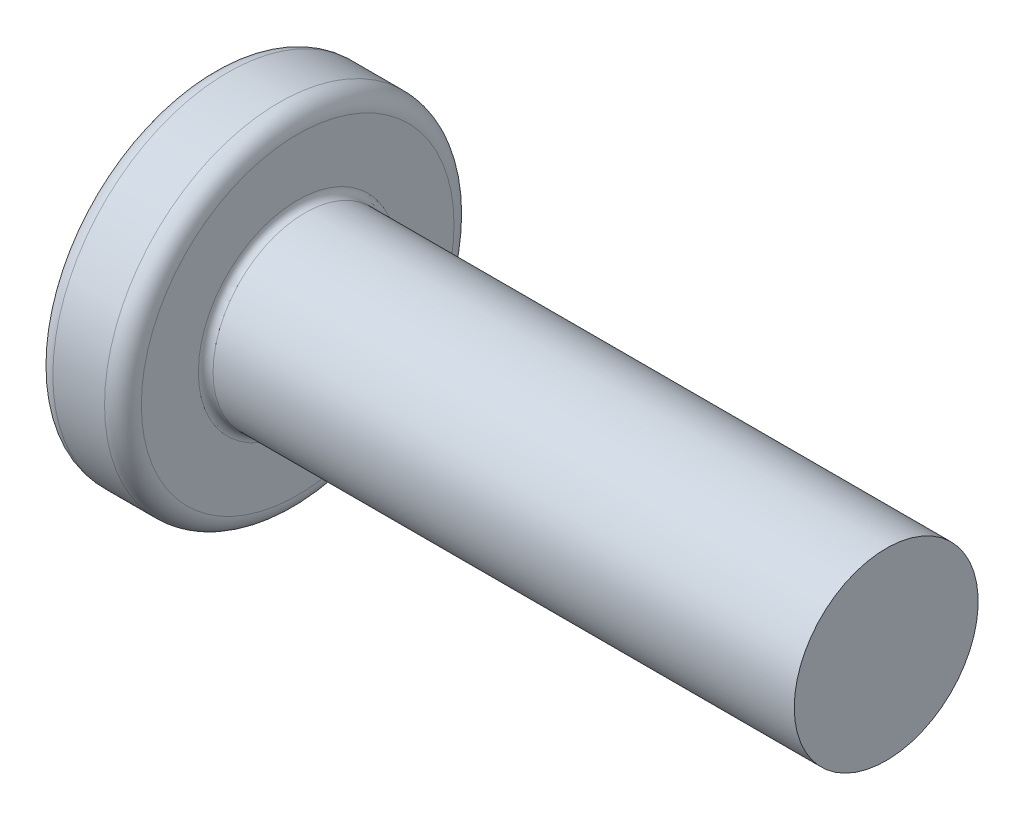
SolidWorks part; units mm, degrees
ref_plane "Plane1" through (0, 0, 0) normal (0, 0, 1) x (1, 0, 0)
ref_plane "Plane2" through (0, 0, 0) normal (0, 1, 0) x (1, 0, 0)
ref_plane "Plane3" through (0, 0, 0) normal (1, 0, 0) x (0, 0, -1)
sketch "BodySke" plane through (0, 0, 0) normal (0, 0, 1) x (1, 0, 0)
  line L0 (3.7, 2.5) -> (3.7, 4.75)
  line L1 (4.1, 6.35) -> (4.1, -3.175) construction
  line L2 (-25.4, 0) -> (127, 0) construction
  line L3 (19.7, 0) -> (0, 0)
  line L4 (3.7, 2.5) -> (19.7, 2.5)
  line L5 (19.7, 2.5) -> (19.7, 0)
  line L6 (1.7942, 4.75) -> (3.7, 4.75)
  line L8 (3.7, 6.35) -> (3.7, -3.175) construction
  arc A0 (1.4243, 4.5563) -> (0, 0) centre (8, 0) ccw
  arc A2 (1.4243, 4.5563) -> (1.7942, 4.75) centre (1.7942, 4.3) cw
  dimension "Head_fillet_rad" = 0.45
  dimension "Head_crown_rad" = 8
  dimension "Head_ht" = 3.7
  dimension "Diameter" = 5
  dimension "Length" = 16
  dimension "Head_dia" = 9.5
  dimension "Advance" = 0.8
  dimension "Thread_nom" = 16
revolve "Base-Revolve" add sketch "BodySke"
fillet "Fillet1" radius 0.2 1 edges at (3.7, 0, 2.5)
sketch "Sketch3" plane through (0, 0, 0) normal (1, 0, 0) x (0, 0, -1)
  line L0 (0.515, -2.35) -> (-0.515, -2.35)
  line L1 (0.515, -2.35) -> (0.515, 2.35)
  line L2 (-0.515, 2.35) -> (0.515, 2.35)
  line L3 (-0.515, 2.35) -> (-0.515, -2.35)
  dimension "D1" = 2.35
  dimension "Cross_dia" = 4.7
  dimension "D2" = 0.515
  dimension "Cross_width" = 1.03
ref_plane "Plane4" through (2.74, 0, 0) normal (1, 0, 0) x (0, 0, -1)
sketch "Sketch4" plane through (2.74, 0, 0) normal (1, 0, 0) x (0, 0, -1)
  line L0 (0.515, -0.9839) -> (-0.515, -0.9839)
  line L1 (0.515, -0.9839) -> (0.515, 0.9839)
  line L2 (-0.515, 0.9839) -> (0.515, 0.9839)
  line L3 (-0.515, 0.9839) -> (-0.515, -0.9839)
  dimension "D1" = 1.03
  dimension "D2" = 1.9678
  dimension "D3" = 0.515
  dimension "D4" = 0.9839
loft "Recess" cut profiles "Sketch3", "Sketch4"
pattern_circular "RecPat" count 2 every 90 about axis through (0, 0, 0) along (1, 0, 0) of "Recess"
sketch "RecCorSke" plane through (0, 0, 0) normal (0, 0, 1) x (1, 0, 0)
  line L0 (-3.175, 0) -> (15.875, 0) construction
  line L1 (-25.4, 0) -> (127, 0) construction
  line L2 (0, 0) -> (0, 1.0426)
  line L3 (0, 1.0426) -> (2.74, 0.851)
  line L4 (2.74, 0.851) -> (3.0165, 0)
  line L5 (3.0165, 0) -> (0, 0)
  dimension "Diameter" = 1.702
  dimension "Depth" = 2.74
  dimension "Draft_angle" = 4
  dimension "Bottom_angle" = 18
revolve "RecessCore" cut sketch "RecCorSke" angle 360 about L0
sketch "ThdSchSke" plane through (0, 0, 0) normal (0, 0, 1) x (1, 0, 0)
  line L0 (5.3, -2.055) -> (4.9884, -2.5)
  line L1 (5.3, -2.055) -> (5.6116, -2.5)
  line L2 (5.6116, -2.5) -> (5.6116, -3.125)
  line L3 (-3.175, 0) -> (5.1513, 0) construction
  line L5 (5.6116, -3.125) -> (4.9884, -3.125)
  line L6 (4.9884, -3.125) -> (4.9884, -2.5)
  dimension "Thread_minor" = 4.11
  dimension "Diameter" = 5
  dimension "Start" = 5.3
  dimension "SideAngle" = 55
  dimension "VeeAngle" = 70
  dimension "Overcut" = 6.25
revolve "ThreadSchematic" [suppressed] cut sketch "ThdSchSke" angle 360 about L3
pattern_linear "ThdSchPat" [suppressed]
fillet "Congé1" radius 0.5 1 edges at (3.7, 0, 4.75)
equation "\"D1@Sketch3\" = \"Cross_dia@Sketch3\" / 2"
equation "\"D2@Sketch3\" = \"Cross_width@Sketch3\" / 2"
equation "\"Depth@RecCorSke\" = \"Cross_depth@Plane4\""
equation "\"D1@Sketch4\" = \"Cross_width@Sketch3\""
equation "\"D2@Sketch4\" = \"Cross_dia@Sketch3\" - 2.0 * \"Cross_depth@Plane4\" * tan(26.5  * 0.017453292)"
equation "\"D3@Sketch4\" = \"D1@Sketch4\" / 2"
equation "\"D4@Sketch4\" = \"D2@Sketch4\" / 2"
equation "\"Thread_length@ThreadCosmetic\" = ((sgn( (\"Length@BodySke\" - \"Advance@BodySke\" * 2.0 ) - \"Thread_nom@BodySke\" )-1)*( (\"Length@BodySke\" - \"Advance@BodySke\" * 2.0 ) - \"Thread_nom@BodySke\" ))/-2+ \"Thread_"
equation "\"Thread_minor@ThdSchSke\" = \"Thread_minor@ThreadCosmetic\""
equation "\"Diameter@ThdSchSke\" = \"Diameter@BodySke\""
equation "\"Overcut@ThdSchSke\" = \"Diameter@BodySke\" * 1.25"
equation "\"Start@ThdSchSke\" = \"Head_ht@BodySke\" + \"Length@BodySke\" - \"Thread_length@ThreadCosmetic\"  '---Non-countersunk---"
equation "\"Num_threads@ThdSchPat\" = int( \"Thread_length@ThreadCosmetic\" / \"Advance@BodySke\" + 0.999 )  + 1"
equation "\"Advance@ThdSchPat\" = \"Thread_length@ThreadCosmetic\" /  (\"Num_threads@ThdSchPat\" - 1) 'relax it"
